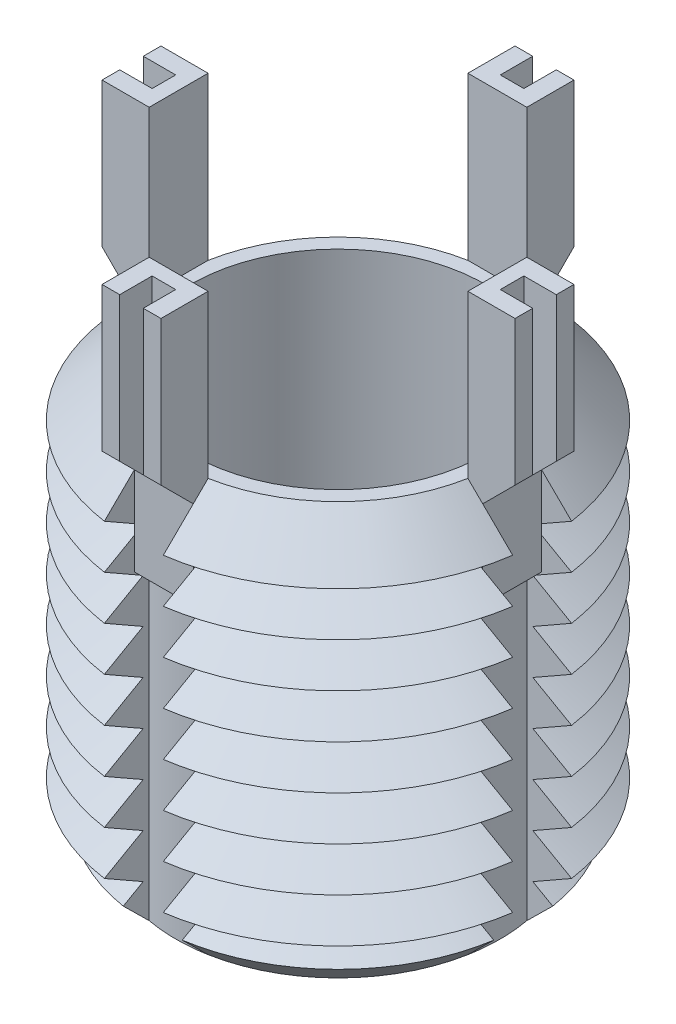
SolidWorks part; units mm, degrees
ref_plane "Front Plane" through (0, 0, 0) normal (0, 0, 1) x (1, 0, 0)
ref_plane "Top Plane" through (0, 0, 0) normal (0, 1, 0) x (1, 0, 0)
ref_plane "Right Plane" through (0, 0, 0) normal (1, 0, 0) x (0, 0, -1)
sketch "Sketch1" plane through (0, 0, 0) normal (0, 1, 0) x (1, 0, 0)
  circle A0 centre (0, 0) radius 7
  dimension "D1" = 14
extrude "Boss-Extrude1" add sketch "Sketch1" against normal blind 14
chamfer "Chamfer1" distance 1.5 angle 45 2 edges at (0, -14, 7) (0, 0, 7)
sketch "Sketch2" plane through (0, 0, 0) normal (1, 0, 0) x (0, 0, -1)
  line L0 (0, 0.8859) -> (0, -9.2617) construction
sketch "Sketch3" plane through (0, 0, 0) normal (1, 0, 0) x (0, 0, -1)
  line L0 (-7, -1.5) -> (-5.701, -2.25)
  line L1 (-5.701, -2.25) -> (-7, -3)
  line L2 (-7, -1.5) -> (-7, -12.5) construction
  line L3 (-7, -3) -> (-7, -1.5)
  dimension "D1" = 1.5
revolve "Cut-Revolve1" cut sketch "Sketch3" angle 360 about L0
pattern_linear "LPattern1" count 8 spacing 1.5 along (0, -1, 0) of "Cut-Revolve1"
sketch "Sketch4" plane through (0, 0, 0) normal (0, 1, 0) x (1, 0, 0)
  line L0 (-5.4083, 1) -> (-6.9282, 1)
  line L2 (-6.9282, -1) -> (-5.4083, -1)
  arc A0 (-5.4083, 1) -> (-5.4083, -1) centre (0, 0) ccw
  arc A1 (-6.9282, 1) -> (-6.9282, -1) centre (0, 0) ccw
  circle A2 centre (0, 0) radius 7 construction
  circle A3 centre (0, 0) radius 5.5 construction
  point P1 (-5.5, 0)
  point P3 (-7, 0)
  point P13 (0, 0)
  dimension "D1" = 2
extrude "Cut-Extrude1" cut sketch "Sketch4" against normal up to surface (14 mm away)
pattern_circular "CirPattern1" count 4 over 360 about axis through (0, 0, 0) along (0, 1, 0) of "Cut-Extrude1"
sketch "Sketch5" plane through (0, 0, 0) normal (1, 0, 0) x (0, 0, -1)
  line L0 (-5.4083, 5.5) -> (-5.4083, -3.5)
  line L1 (-5.4083, -3.5) -> (-5.9083, -3.5)
  line L2 (-5.9083, -3.5) -> (-5.9083, -0.5)
  line L3 (-5.9083, -0.5) -> (-7.0083, 0.6)
  line L4 (-7.0083, 0.6) -> (-7.0083, 5.5)
  line L5 (-7.0083, 5.5) -> (-5.4083, 5.5)
  line L6 (-6.9282, -4.5) -> (-1, -4.5) construction
  point P9 (-1, 0)
  point P10 (-5.9083, -0.5)
  dimension "D1" = 1
  dimension "D2" = 9
  dimension "D3" = 6
  dimension "D4" = 1.6
  dimension "D5" = 0.5
  dimension "D6" = 45
extrude "Boss-Extrude3" add sketch "Sketch5" along normal mid plane 2
pattern_circular "CirPattern2" count 4 over 360 about axis through (0, 0, 0) along (0, 1, 0) of "Boss-Extrude3"
sketch "Sketch6" plane through (0, 5.5, 0) normal (0, 1, 0) x (1, 0, 0)
  line L0 (-7.0083, -1) -> (-7.0083, 1) construction
  line L1 (-7.0083, -0.4) -> (-5.9083, -0.4)
  line L2 (-7.0083, -0.4) -> (-7.0083, 0.4)
  line L3 (-7.0083, 0.4) -> (-5.9083, 0.4)
  line L4 (-5.9083, -0.4) -> (-5.9083, 0.4)
  line L5 (-7.0083, -0.4) -> (-5.9083, 0.4) construction
  line L6 (-7.0083, 0.4) -> (-5.9083, -0.4) construction
  line L7 (7.0083, 1) -> (7.0083, -1) construction
  line L8 (-0.4, 5.9083) -> (0.4, 5.9083)
  line L9 (-0.4, 5.9083) -> (-0.4, 7.0083)
  line L10 (-0.4, 7.0083) -> (0.4, 7.0083)
  line L11 (0.4, 5.9083) -> (0.4, 7.0083)
  line L12 (-0.4, 5.9083) -> (0.4, 7.0083) construction
  line L13 (-0.4, 7.0083) -> (0.4, 5.9083) construction
  line L14 (5.9083, -0.4) -> (7.0083, -0.4)
  line L15 (5.9083, -0.4) -> (5.9083, 0.4)
  line L16 (5.9083, 0.4) -> (7.0083, 0.4)
  line L17 (7.0083, -0.4) -> (7.0083, 0.4)
  line L18 (5.9083, -0.4) -> (7.0083, 0.4) construction
  line L19 (5.9083, 0.4) -> (7.0083, -0.4) construction
  line L20 (-0.4, -7.0083) -> (0.4, -7.0083)
  line L21 (-0.4, -7.0083) -> (-0.4, -5.9083)
  line L22 (-0.4, -5.9083) -> (0.4, -5.9083)
  line L23 (0.4, -7.0083) -> (0.4, -5.9083)
  line L24 (-0.4, -7.0083) -> (0.4, -5.9083) construction
  line L25 (-0.4, -5.9083) -> (0.4, -7.0083) construction
  line L26 (-1, 7.0083) -> (1, 7.0083) construction
  line L27 (1, -7.0083) -> (-1, -7.0083) construction
  point P0 (-6.4583, 0)
  point P7 (-7.0083, 0)
  point P8 (-7.0083, 0)
  point P9 (0, 6.4583)
  point P14 (6.4583, 0)
  point P19 (0, -6.4583)
  point P24 (0, 7.0083)
  point P25 (7.0083, 0)
  point P26 (7.0083, 0)
  point P27 (0, 7.0083)
  point P30 (0, -7.0083)
  point P33 (0, -7.0083)
  dimension "D1" = 0.8
  dimension "D2" = 1.1
extrude "Cut-Extrude3" cut sketch "Sketch6" against normal through all both and the other way through all
sketch "Sketch7" plane through (0, 0, 0) normal (0, 1, 0) x (1, 0, 0)
  circle A0 centre (0, 0) radius 5
  dimension "D1" = 10
extrude "Cut-Extrude4" cut sketch "Sketch7" against normal up to surface (14 mm away)
